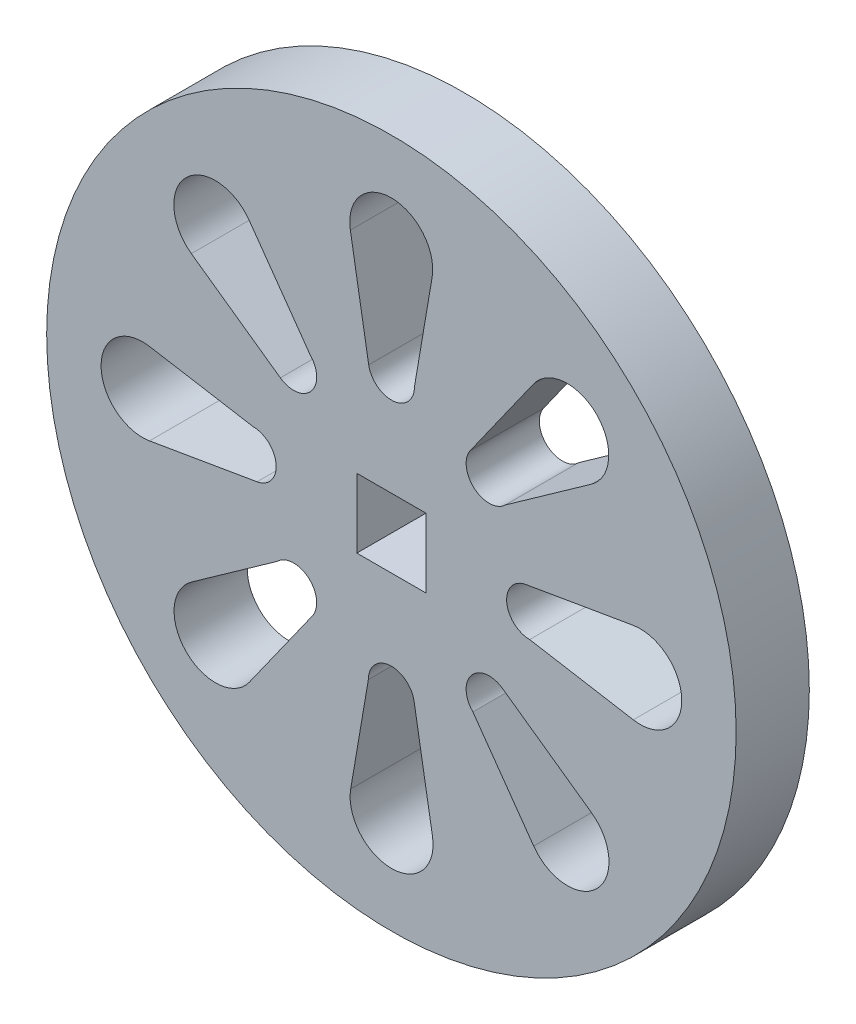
SolidWorks part; units mm, degrees
ref_plane "Front Plane" through (0, 0, 0) normal (0, 0, 1) x (1, 0, 0)
ref_plane "Top Plane" through (0, 0, 0) normal (0, 1, 0) x (1, 0, 0)
ref_plane "Right Plane" through (0, 0, 0) normal (1, 0, 0) x (0, 0, -1)
sketch "Sketch1" plane through (0, 0, 0) normal (0, 0, 1) x (1, 0, 0)
  circle A0 centre (0, 0) radius 47.5
  dimension "D1" = 95
extrude "Boss-Extrude1" add sketch "Sketch1" along normal blind 10.0838
sketch "Sketch2" plane through (0, 0, 10.0838) normal (0, 0, 1) x (1, 0, 0)
  line L1 (-4.7625, 4.7625) -> (4.7625, 4.7625)
  line L2 (-4.7625, 4.7625) -> (-4.7625, -4.7625)
  line L3 (-4.7625, -4.7625) -> (4.7625, -4.7625)
  line L4 (4.7625, 4.7625) -> (4.7625, -4.7625)
  line L5 (-4.7625, 4.7625) -> (4.7625, -4.7625) construction
  line L6 (-4.7625, -4.7625) -> (4.7625, 4.7625) construction
  point P0 (0, 0)
  dimension "D1" = 9.525
  dimension "D2" = 9.525
extrude "Cut-Extrude1" cut sketch "Sketch2" against normal through all
sketch "Sketch3" plane through (0, 0, 10.0838) normal (0, 0, 1) x (1, 0, 0)
  circle A0 centre (0, 0) radius 45.72 construction
  circle A2 centre (0, 29.845) radius 4.445
  dimension "D1" = 91.44
  dimension "D3" = 8.89
  dimension "D4" = 29.845
extrude "Cut-Extrude2" [suppressed] cut sketch "Sketch3" against normal through all
pattern_circular "CirPattern1" [suppressed] count 8 over 360
sketch "Sketch4" plane through (0, 0, 10.0838) normal (0, 0, 1) x (1, 0, 0)
  line L2 (-3.1298, 18.5161) -> (-5.6566, 33.329)
  line L3 (3.175, 19.05) -> (5.6107, 33.329)
  arc A1 (-3.1298, 18.5161) -> (3.175, 19.05) centre (0, 19.05) ccw
  arc A2 (-5.6566, 33.329) -> (5.6107, 33.329) centre (-0.0229, 34.29) cw
  dimension "D1" = 5.715
  dimension "D3" = 3.175
  dimension "D4" = 15.24
  dimension "D2" = 19.05
extrude "Cut-Extrude3" cut sketch "Sketch4" against normal through all
pattern_circular "CirPattern2" count 8 over 360 about axis through (0, 0, 0) along (0, 0, 1) of "Cut-Extrude3"
